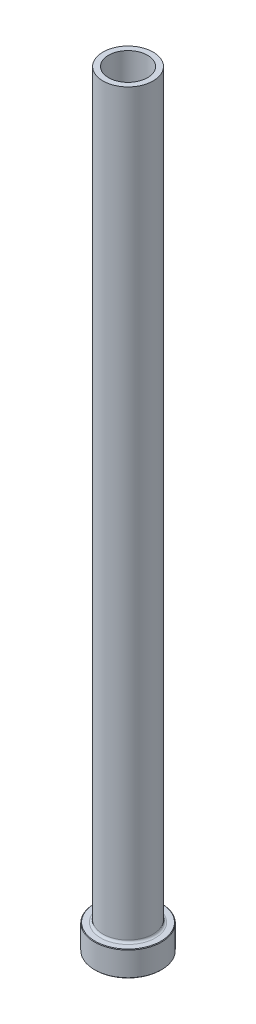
SolidWorks part; units mm, degrees
ref_plane "Front Plane" through (0, 0, 0) normal (0, 0, 1) x (1, 0, 0)
ref_plane "Top Plane" through (0, 0, 0) normal (0, 1, 0) x (1, 0, 0)
ref_plane "Right Plane" through (0, 0, 0) normal (1, 0, 0) x (0, 0, -1)
sketch "Sketch1" plane through (0, 0, 0) normal (0, 0, 1) x (1, 0, 0)
  line L0 (-7, 275) -> (-9, 275)
  line L1 (-9, 275) -> (-9, 9)
  line L2 (-9, 9) -> (-12, 9)
  line L3 (-12, 9) -> (-12, 0)
  line L4 (13.2, 0) -> (-13.2, 0) construction
  line L5 (-12, 0) -> (-7.25, 0)
  line L6 (-7, 220) -> (-7, 275)
  line L7 (0, 92.1877) -> (0, -15.5353) construction
  line L8 (0, -13.2) -> (0, 13.2) construction
  line L9 (-7, 220) -> (-7.25, 208)
  line L10 (-7.25, 208) -> (-7.25, 0)
  dimension "D1" = 0.25
  dimension "ID" = 14
  dimension "OD" = 18
  dimension "L" = 275
  dimension "H" = 24
  dimension "T" = 9
  dimension "N" = 55
  dimension "D2" = 12
revolve "Revolve1" add sketch "Sketch1" angle 360 about L7
fillet "Fillet1" radius 0.8 1 edges at (0, 9, 9)
chamfer "Chamfer1" distance 0.2 angle 45 2 edges at (0, 9, 12) (0, 0, 12)
chamfer "Chamfer3" distance 0.5 angle 45 1 edges at (0, 0, 7.25)
